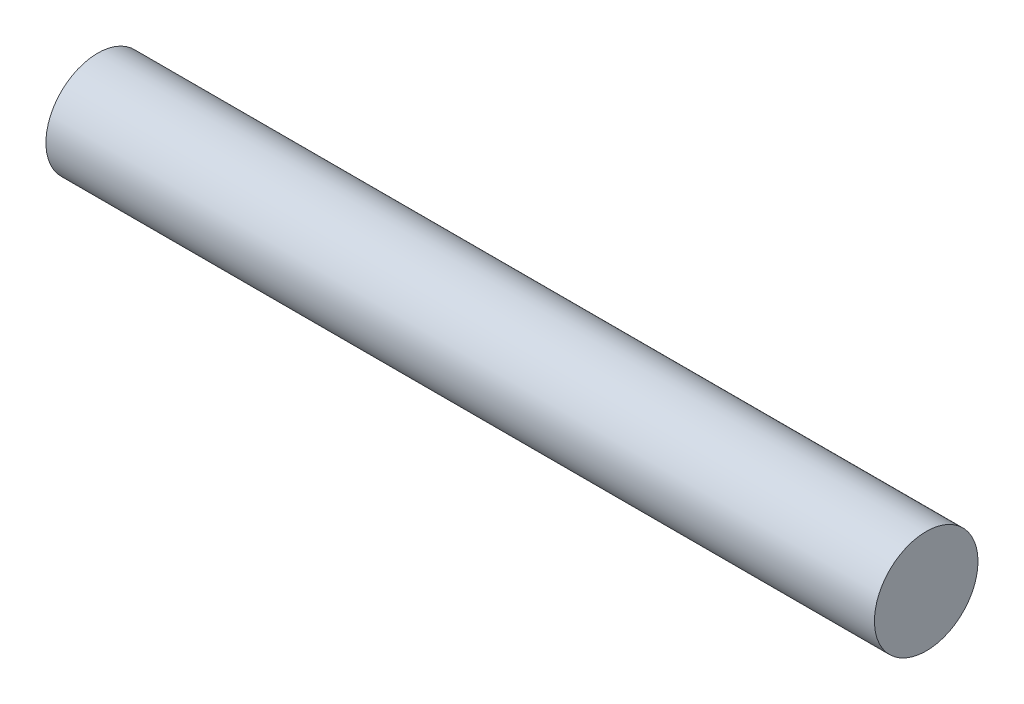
SolidWorks part; units mm, degrees
ref_plane "Front Plane" through (0, 0, 0) normal (1, 0, 0) x (0, 1, 0)
ref_plane "Top Plane" through (0, 0, 0) normal (0, 0, 1) x (0, 1, 0)
ref_plane "Right Plane" through (0, 0, 0) normal (0, 1, 0) x (-1, 0, 0)
sketch "Sketch3" plane through (0, 0, 0) normal (1, 0, 0) x (0, 1, 0)
  circle A0 centre (0, 0) radius 1.5875
extrude "Boss-Extrude1" add sketch "Sketch3" along normal blind 25.4
equation "\"D1@Sketch3\"=0.125in"
equation "\"D1@Boss-Extrude1\"=1.00in"
